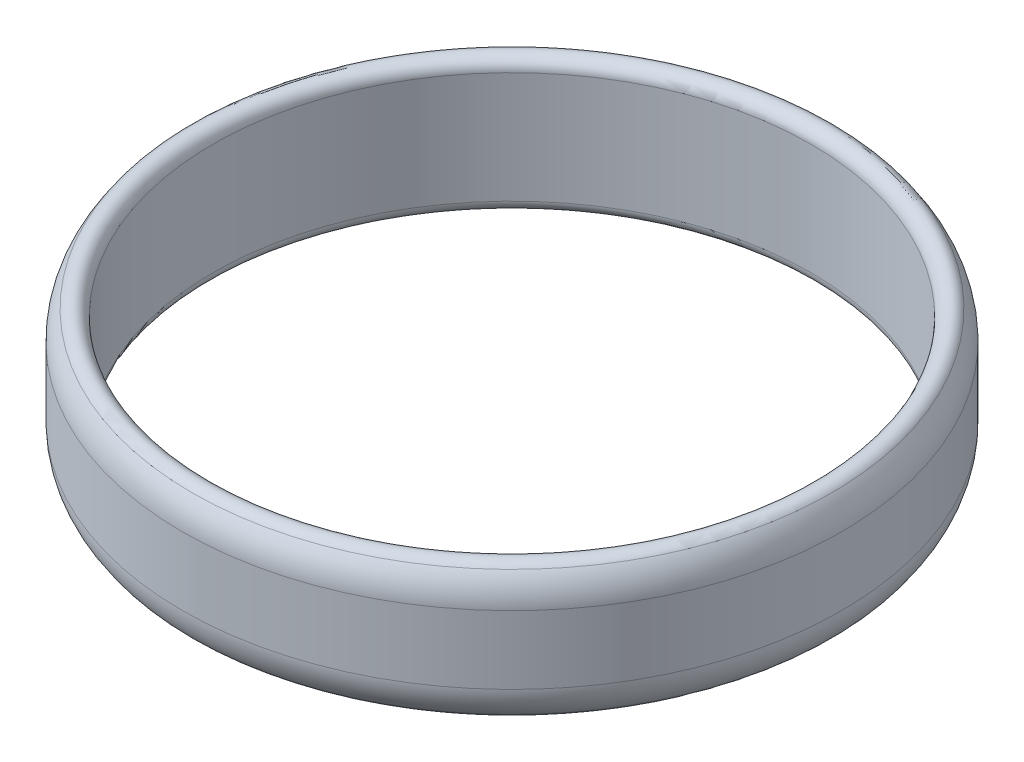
SolidWorks part; units mm, degrees
other "Camera1"
ref_plane "Front Plane" through (0, 0, 0) normal (0, 0, 1) x (1, 0, 0)
ref_plane "Top Plane" through (0, 0, 0) normal (0, 1, 0) x (1, 0, 0)
ref_plane "Right Plane" through (0, 0, 0) normal (1, 0, 0) x (0, 0, -1)
sketch "Sketch1" plane through (0, 0, 0) normal (0, 0, 1) x (1, 0, 0)
  line L0 (0, 0) -> (0, 14.6885) construction
  line L1 (64.5905, 0) -> (64.5905, 33.5598)
  line L2 (64.5905, 33.5598) -> (71.2052, 33.5598)
  line L3 (71.2052, 33.5598) -> (71.2052, 0)
  line L4 (71.2052, 0) -> (64.5905, 0)
revolve "Revolve1" add sketch "Sketch1" angle 360 about L0
fillet "Fillet1" radius 10 2 edges at (0, 0, -71.2052) (0, 33.5598, -71.2052)
fillet "Fillet2" radius 2.5 2 edges at (0, 33.5598, -64.5905) (0, 0, -64.5905)
